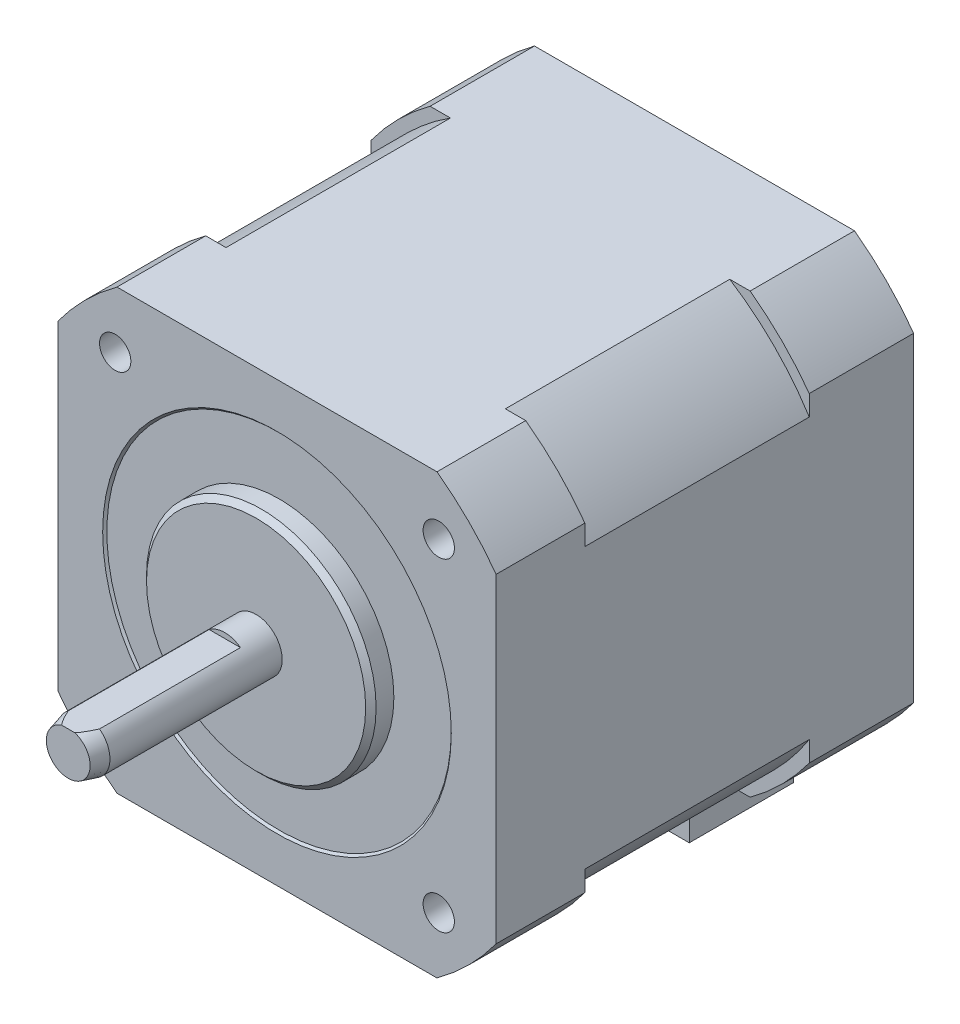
SolidWorks part; units mm, degrees
ref_plane "正面" through (0, 0, 0) normal (0, 0, 1) x (1, 0, 0)
ref_plane "平面" through (0, 0, 0) normal (0, 1, 0) x (1, 0, 0)
ref_plane "右側面" through (0, 0, 0) normal (1, 0, 0) x (0, 0, -1)
sketch "ｽｹｯﾁ1" plane through (0, 0, 0) normal (0, 0, 1) x (1, 0, 0)
  circle A0 centre (0, 0) radius 2.5
  dimension "D1" = 5
extrude "押し出し1" add sketch "ｽｹｯﾁ1" along normal blind 18
sketch "ｽｹｯﾁ2" plane through (0, 0, 0) normal (0, 0, -1) x (-1, 0, 0)
  circle A0 centre (0, 0) radius 11
  dimension "D1" = 22
extrude "押し出し2" add sketch "ｽｹｯﾁ2" along normal blind 2
sketch "ｽｹｯﾁ3" plane through (0, 0, -2) normal (0, 0, -1) x (-1, 0, 0)
  line L1 (-21, 21) -> (21, 21)
  line L2 (-21, 21) -> (-21, -21)
  line L3 (-21, -21) -> (21, -21)
  line L4 (21, 21) -> (21, -21)
  line L5 (-21, 21) -> (21, -21) construction
  line L6 (-21, -21) -> (21, 21) construction
  point P0 (0, 0)
  point P6 (0, 0)
  dimension "D1" = 42
  dimension "D2" = 42
extrude "押し出し3" add sketch "ｽｹｯﾁ3" along normal blind 8.5
sketch "Sketch8" plane through (0, 0, -2) normal (0, 0, 1) x (1, 0, 0)
  circle A0 centre (0, 0) radius 26
  dimension "D1" = 52
extrude "Extrude8" cut sketch "Sketch8" against normal blind 34 flip side to cut
sketch "Sketch16" plane through (0, 0, -2) normal (0, 0, 1) x (1, 0, 0)
  circle A0 centre (-15.5, 15.5) radius 1.5
  circle A1 centre (15.5, 15.5) radius 1.5
  circle A2 centre (15.5, -15.5) radius 1.5
  circle A3 centre (-15.5, -15.5) radius 1.5
  dimension "D1" = 3
  dimension "D2" = 3
  dimension "D3" = 3
  dimension "D4" = 3
  dimension "D5" = 15.5
  dimension "D6" = 31
  dimension "D7" = 15.5
  dimension "D8" = 31
  dimension "D9" = 15.5
  dimension "D10" = 31
  dimension "D11" = 15.5
  dimension "D12" = 31
extrude "Extrude15" cut sketch "Sketch16" against normal blind 4.5
sketch "Sketch9" plane through (0, 0, -10.5) normal (0, 0, -1) x (-1, 0, 0)
  line L4 (-21, 15.3297) -> (-21, -15.3297) construction
  line L5 (-15.3297, -21) -> (15.3297, -21) construction
  line L6 (21, -15.3297) -> (21, 15.3297) construction
  line L7 (15.3297, 21) -> (-15.3297, 21) construction
  line L8 (-21, 13.3795) -> (-21, -13.3795)
  line L9 (-13.3795, -21) -> (13.3795, -21)
  line L10 (21, -13.3795) -> (21, 13.3795)
  line L11 (13.3795, 21) -> (-13.3795, 21)
  arc A1 (21, 13.3795) -> (13.3795, 21) centre (0, 0) ccw
  arc A2 (-13.3795, 21) -> (-21, 13.3795) centre (0, 0) ccw
  arc A3 (-21, -13.3795) -> (-13.3795, -21) centre (0, 0) ccw
  arc A4 (13.3795, -21) -> (21, -13.3795) centre (0, 0) ccw
  dimension "D1" = 49.8
extrude "Extrude9" add sketch "Sketch9" along normal blind 21.5
sketch "Sketch11" plane through (0, 0, -32) normal (0, 0, -1) x (-1, 0, 0)
  line L0 (-21, 13.3795) -> (-21, -13.3795) construction
  line L1 (-21, 15.3297) -> (-21, 13.3795) construction
  line L2 (-21, -13.3795) -> (-21, -15.3297) construction
  line L3 (-13.3795, -21) -> (13.3795, -21) construction
  line L4 (-15.3297, -21) -> (-13.3795, -21) construction
  line L5 (13.3795, -21) -> (15.3297, -21) construction
  line L6 (21, -15.3297) -> (21, -13.3795) construction
  line L7 (21, -13.3795) -> (21, 13.3795) construction
  line L8 (21, 13.3795) -> (21, 15.3297) construction
  line L9 (15.3297, 21) -> (13.3795, 21) construction
  line L10 (-13.3795, 21) -> (-15.3297, 21) construction
  line L11 (-21, 13.3795) -> (-21, -13.3795)
  line L12 (-21, 15.3297) -> (-21, 13.3795)
  line L13 (-21, -13.3795) -> (-21, -15.3297)
  line L14 (-13.3795, -21) -> (13.3795, -21)
  line L15 (-15.3297, -21) -> (-13.3795, -21)
  line L16 (13.3795, -21) -> (15.3297, -21)
  line L17 (21, -15.3297) -> (21, -13.3795)
  line L18 (21, -13.3795) -> (21, 13.3795)
  line L19 (21, 13.3795) -> (21, 15.3297)
  line L20 (15.3297, 21) -> (13.3795, 21)
  line L21 (-13.3795, 21) -> (-15.3297, 21)
  line L22 (13.3795, 21) -> (-13.3795, 21) construction
  line L23 (13.3795, 21) -> (-13.3795, 21)
  arc A0 (-15.3297, 21) -> (-21, 15.3297) centre (0, 0) ccw construction
  arc A1 (-21, -15.3297) -> (-15.3297, -21) centre (0, 0) ccw construction
  arc A2 (15.3297, -21) -> (21, -15.3297) centre (0, 0) ccw construction
  arc A3 (21, 15.3297) -> (15.3297, 21) centre (0, 0) ccw construction
  arc A4 (-15.3297, 21) -> (-21, 15.3297) centre (0, 0) ccw
  arc A5 (-21, -15.3297) -> (-15.3297, -21) centre (0, 0) ccw
  arc A6 (15.3297, -21) -> (21, -15.3297) centre (0, 0) ccw
  arc A7 (21, 15.3297) -> (15.3297, 21) centre (0, 0) ccw
extrude "Extrude11" add sketch "Sketch11" along normal blind 10
chamfer "Chamfer5" distance 1.5 angle 15 1 edges at (2.5, 0, 18)
sketch "Sketch2" plane through (0, 0, 18) normal (0, 0, 1) x (1, 0, 0)
  line L1 (-4.7278, 5.1185) -> (3.4221, 5.1185)
  line L2 (-4.7278, 5.1185) -> (-4.7278, 2)
  line L3 (-4.7278, 2) -> (3.4221, 2)
  line L4 (3.4221, 5.1185) -> (3.4221, 2)
  dimension "D1" = 2
extrude "Extrude2" cut sketch "Sketch2" against normal blind 15
sketch "Sketch6" plane through (0, 0, -2) normal (0, 0, 1) x (1, 0, 0)
  circle A0 centre (0, 0) radius 16.5
  circle A1 centre (0, 0) radius 11 construction
  circle A2 centre (0, 0) radius 11
  dimension "D2" = 33
extrude "Extrude6" cut sketch "Sketch6" against normal blind 0.2
chamfer "Chamfer2" distance 0.5 angle 45 1 edges at (-11, 0, 0)
chamfer "Chamfer7" distance 0.2 angle 45 1 edges at (16.5, 0, -2)
sketch "Sketch13" plane through (0, -21, 0) normal (0, -1, 0) x (1, 0, 0)
  line L0 (15.3297, -42) -> (-15.3297, -42) construction
  line L1 (-9.5, -32) -> (9.5, -32)
  line L2 (-9.5, -32) -> (-9.5, -42)
  line L3 (-9.5, -42) -> (9.5, -42)
  line L4 (9.5, -32) -> (9.5, -42)
  line L5 (-21, -42) -> (-21, -32) construction
  dimension "D1" = 10
  dimension "11.5" = 11.5
  dimension "D2" = 19
extrude "Extrude12" add sketch "Sketch13" along normal blind 6.7
sketch "Sketch14" plane through (0, 0, -42) normal (0, 0, -1) x (-1, 0, 0)
  circle A0 centre (0, 0) radius 2.5
extrude "Extrude13" add sketch "Sketch14" along normal blind 15
chamfer "Chamfer8" distance 1.5 angle 15 1 edges at (-2.5, 0, -57)
sketch "Sketch15" plane through (0, 0, -57) normal (0, 0, -1) x (-1, 0, 0)
  line L0 (0, 0) -> (-7.0229, 0) construction
  line L1 (-5, 4) -> (5, 4)
  line L2 (-5, 4) -> (-5, 2)
  line L3 (-5, 2) -> (5, 2)
  line L4 (5, 4) -> (5, 2)
  line L5 (0, 0) -> (0, 9.1437) construction
  dimension "D1" = 10
  dimension "D2" = 2
  dimension "D3" = 5
  dimension "D4" = 2
extrude "Extrude14" cut sketch "Sketch15" against normal blind 15
